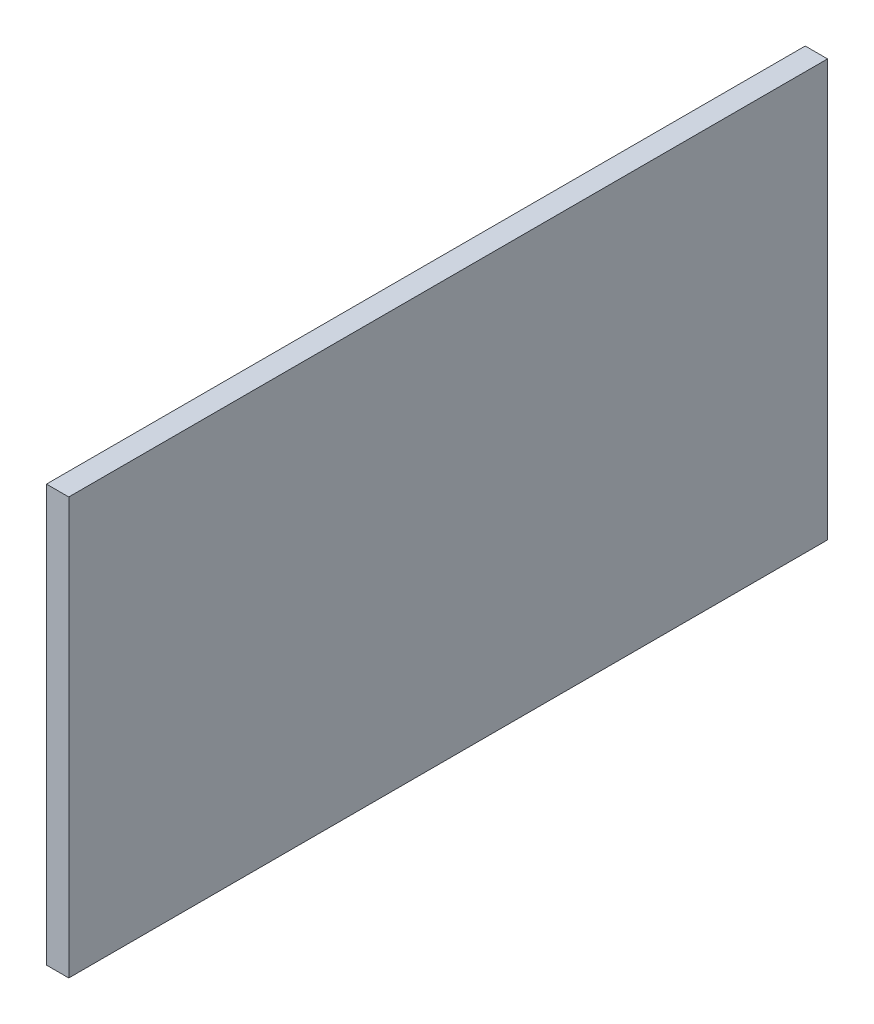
SolidWorks part; units mm, degrees
ref_plane "Front Plane" through (0, 0, 0) normal (0, 0, 1) x (1, 0, 0)
ref_plane "Top Plane" through (0, 0, 0) normal (0, 1, 0) x (1, 0, 0)
ref_plane "Right Plane" through (0, 0, 0) normal (1, 0, 0) x (0, 0, -1)
sketch "Sketch1" plane through (0, 0, 0) normal (0, 0, 1) x (1, 0, 0)
  line L1 (0, 0) -> (19.05, 0)
  line L2 (0, 0) -> (0, 355.6)
  line L3 (0, 355.6) -> (19.05, 355.6)
  line L4 (19.05, 0) -> (19.05, 355.6)
  dimension "D1" = 19.05
  dimension "D2" = 355.6
extrude "Extrude1" add sketch "Sketch1" along normal blind 647.7
